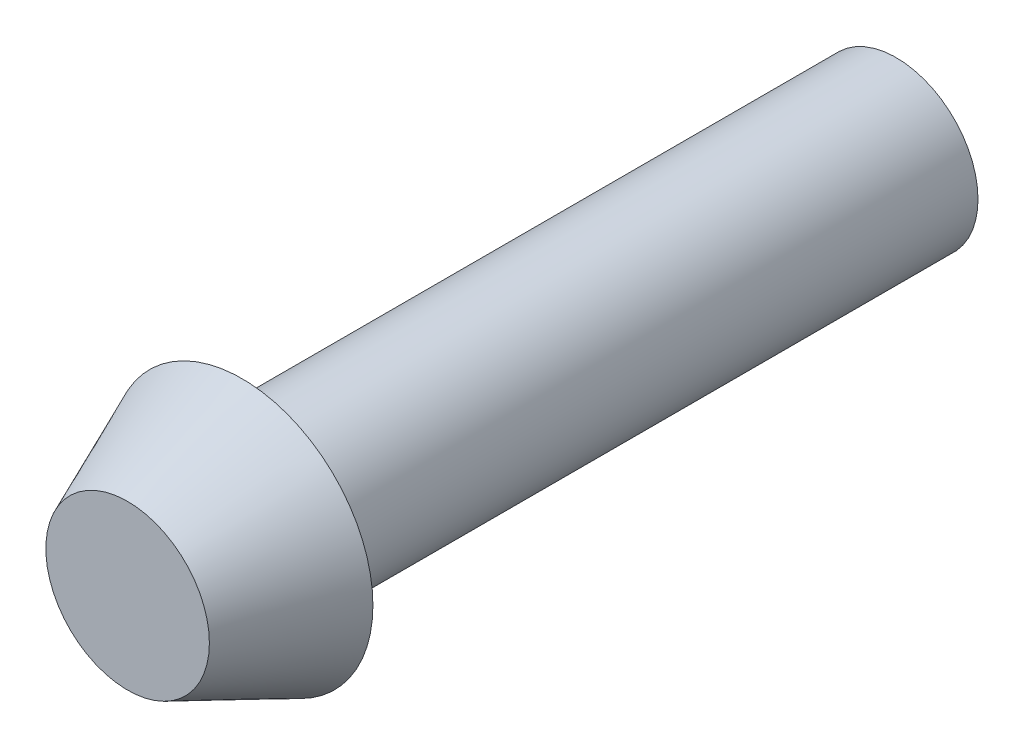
SolidWorks part; units mm, degrees
ref_plane "Front Plane" through (0, 0, 0) normal (0, 0, 1) x (1, 0, 0)
ref_plane "Top Plane" through (0, 0, 0) normal (0, 1, 0) x (1, 0, 0)
ref_plane "Right Plane" through (0, 0, 0) normal (1, 0, 0) x (0, 0, -1)
other "Configuration Table"
sketch "BaseBodySke" plane through (0, 0, 0) normal (0, 1, 0) x (1, 0, 0)
  line L0 (-5.08, 4.445) -> (-3.175, 4.445)
  line L1 (0, 0) -> (0, 54.1082) construction
  line L2 (0, 0) -> (0, 29.845)
  line L3 (0, 29.845) -> (-3.175, 29.845)
  line L4 (-3.175, 4.445) -> (-3.175, 29.845)
  line L5 (-5.08, 29.845) -> (-5.08, 4.445) construction
  line L6 (-5.08, 0) -> (-5.08, 4.445) construction
  line L7 (0, 0) -> (-3.175, 0)
  line L8 (-3.175, 0) -> (-5.08, 4.445)
  dimension "Diameter" = 6.35
  dimension "Head_Diameter" = 10.16
  dimension "Length" = 25.4
  dimension "Head_Depth" = 4.445
revolve "BaseBody" add sketch "BaseBodySke" angle 360 about L1
